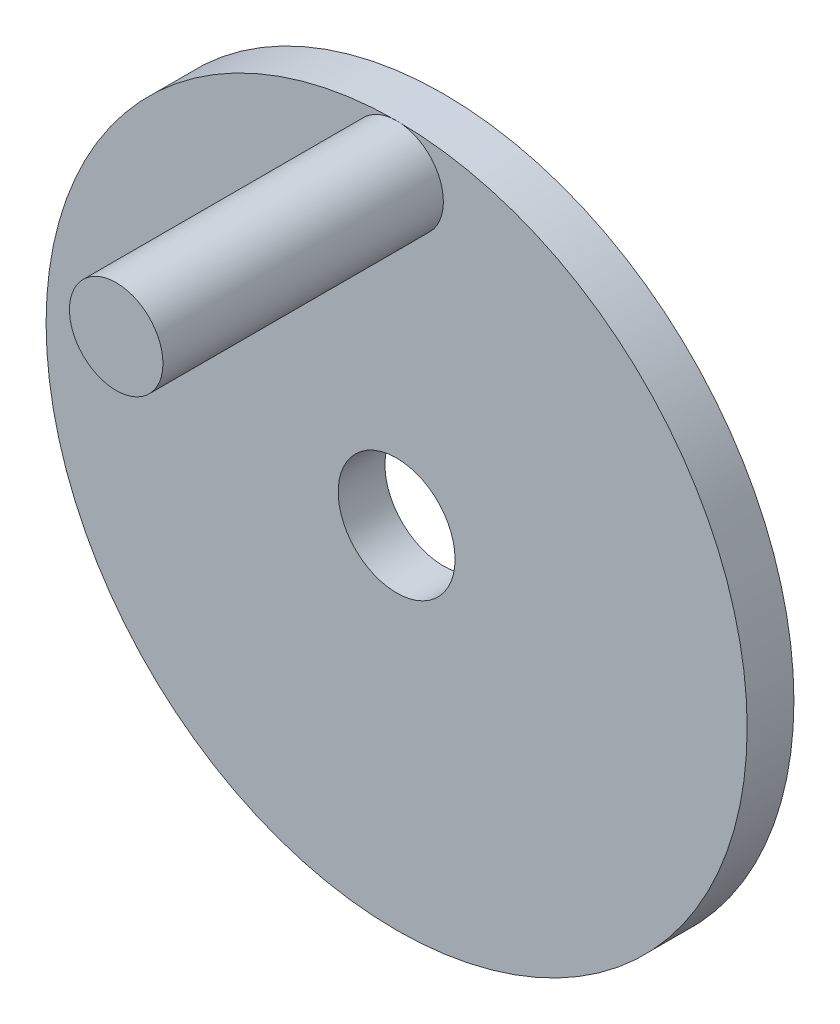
SolidWorks part; units mm, degrees
ref_plane "Front Plane" through (0, 0, 0) normal (0, 0, 1) x (1, 0, 0)
ref_plane "Top Plane" through (0, 0, 0) normal (0, 1, 0) x (1, 0, 0)
ref_plane "Right Plane" through (0, 0, 0) normal (1, 0, 0) x (0, 0, -1)
sketch "Sketch1" plane through (0, 0, 0) normal (0, 0, 1) x (1, 0, 0)
  circle A0 centre (0, 0) radius 19.05
  dimension "D1" = 38.1
extrude "Boss-Extrude1" add sketch "Sketch1" along normal blind 2.54
sketch "Sketch2" plane through (0, 0, 2.54) normal (0, 0, 1) x (1, 0, 0)
  line L0 (0, 0) -> (0, 16.51) construction
  circle A0 centre (0, 16.51) radius 2.54
  circle A1 centre (0, 0) radius 19.05 construction
  dimension "D1" = 5.08
extrude "Boss-Extrude2" add sketch "Sketch2" along normal blind 15.24
sketch "Sketch3" plane through (0, 0, 2.54) normal (0, 0, 1) x (1, 0, 0)
  circle A0 centre (0, 0) radius 3.175
extrude "Cut-Extrude1" cut sketch "Sketch3" against normal through all
equation "\"dowel thick\"= 1 / 4"
equation "\"D1@Sketch3\"=\"dowel thick\""
